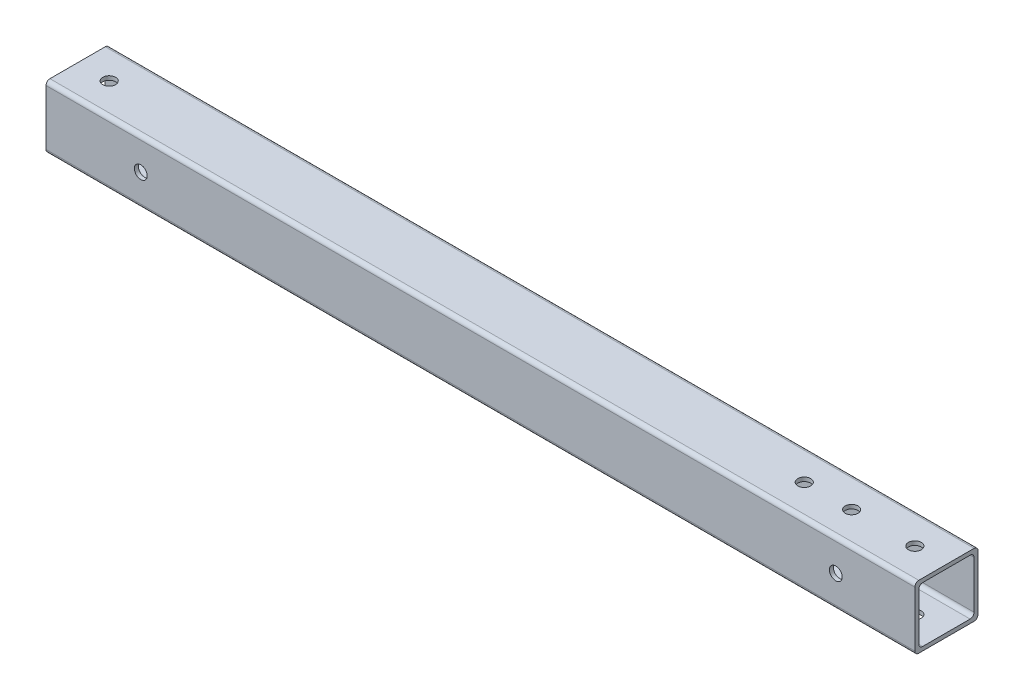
SolidWorks part; units mm, degrees
ref_plane "Front Plane" through (0, 0, 0) normal (0, 0, 1) x (1, 0, 0)
ref_plane "Top Plane" through (0, 0, 0) normal (0, 1, 0) x (1, 0, 0)
ref_plane "Right Plane" through (0, 0, 0) normal (1, 0, 0) x (0, 0, -1)
sketch "Sketch1" plane through (0, 0, 0) normal (0, 1, 0) x (1, 0, 0)
  line L1 (0, 0) -> (-1397, 0)
  line L2 (0, 0) -> (0, -101.6)
  line L3 (0, -101.6) -> (-1397, -101.6)
  line L4 (-1397, 0) -> (-1397, -101.6)
  dimension "D1" = 1397
  dimension "D2" = 101.6
extrude "Extrude1" add sketch "Sketch1" along normal blind 101.6
sketch "Sketch2" plane through (-1397, 0, 0) normal (-1, 0, 0) x (0, 0, 1)
  line L0 (0, 101.6) -> (101.6, 101.6) construction
  line L1 (6.35, 95.25) -> (95.25, 95.25)
  line L2 (6.35, 95.25) -> (6.35, 6.35)
  line L3 (6.35, 6.35) -> (95.25, 6.35)
  line L4 (95.25, 95.25) -> (95.25, 6.35)
  line L5 (0, 0) -> (101.6, 0) construction
  line L6 (101.6, 101.6) -> (101.6, 0) construction
  line L7 (0, 101.6) -> (0, 0) construction
  dimension "D1" = 6.35
  dimension "D2" = 6.35
  dimension "D3" = 6.35
  dimension "D4" = 6.35
extrude "Cut-Extrude1" cut sketch "Sketch2" against normal up to next
fillet "Fillet1" radius 6.35 8 edges at (-698.5, 6.35, 95.25) (-698.5, 0, 101.6) (-698.5, 101.6, 101.6) (-698.5, 95.25, 95.25) (-698.5, 95.25, 6.35) (-698.5, 101.6, 0) (-698.5, 6.35, 6.35) (-698.5, 0, 0)
sketch "Sketch3" plane through (0, 0, 0) normal (0, -1, 0) x (1, 0, 0)
  line L0 (0, 95.25) -> (0, 6.35) construction
  line L1 (-1397, 6.35) -> (0, 6.35) construction
  circle A0 centre (-1346.2, 50.8) radius 10.3188
  dimension "D1" = 20.6375
  dimension "D2" = 1346.2
  dimension "D3" = 44.45
extrude "Cut-Extrude2" cut sketch "Sketch3" against normal blind 101.6
sketch "Sketch4" plane through (0, 0, 0) normal (0, 0, -1) x (-1, 0, 0)
  line L0 (0, 95.25) -> (0, 6.35) construction
  line L1 (0, 6.35) -> (1397, 6.35) construction
  circle A0 centre (1244.6, 50.8) radius 10.3188
  dimension "D1" = 20.6375
  dimension "D2" = 1244.6
  dimension "D3" = 44.45
extrude "Cut-Extrude3" cut sketch "Sketch4" against normal blind 101.6
sketch "Sketch5" plane through (0, 0, 0) normal (0, 0, -1) x (-1, 0, 0)
  line L0 (1397, 95.25) -> (1397, 6.35) construction
  line L1 (0, 6.35) -> (1397, 6.35) construction
  circle A0 centre (127, 50.8) radius 10.3187
  dimension "D1" = 20.6375
  dimension "D2" = 1270
  dimension "D3" = 44.45
extrude "Cut-Extrude4" cut sketch "Sketch5" against normal blind 101.6
sketch "Sketch6" plane through (0, 0, 0) normal (0, -1, 0) x (1, 0, 0)
  line L0 (0, 95.25) -> (0, 6.35) construction
  line L1 (-1397, 6.35) -> (0, 6.35) construction
  circle A0 centre (-50.8, 50.8) radius 10.3188
  dimension "D1" = 20.6375
  dimension "D2" = 50.8
  dimension "D3" = 44.45
extrude "Cut-Extrude5" cut sketch "Sketch6" against normal blind 101.6
sketch "Sketch7" plane through (0, 0, 0) normal (0, -1, 0) x (1, 0, 0)
  line L0 (0, 95.25) -> (0, 6.35) construction
  line L1 (-1397, 6.35) -> (0, 6.35) construction
  circle A0 centre (-152.4, 50.8) radius 10.3187
  dimension "D1" = 20.6375
  dimension "D2" = 152.4
  dimension "D3" = 44.45
extrude "Cut-Extrude6" cut sketch "Sketch7" against normal blind 101.6
sketch "Sketch8" plane through (0, 0, 0) normal (0, -1, 0) x (1, 0, 0)
  line L0 (0, 95.25) -> (0, 6.35) construction
  line L1 (-1397, 6.35) -> (0, 6.35) construction
  circle A0 centre (-228.6, 50.8) radius 10.3187
  dimension "D1" = 20.6375
  dimension "D2" = 228.6
  dimension "D3" = 44.45
extrude "Cut-Extrude7" cut sketch "Sketch8" against normal blind 101.6
